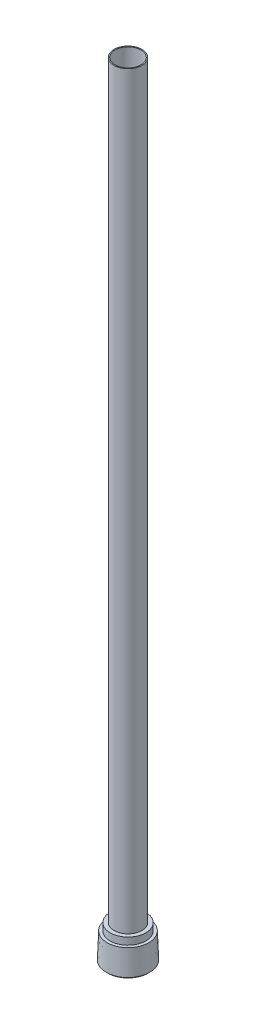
SolidWorks part; units mm, degrees
ref_plane "Front Plane" through (0, 0, 0) normal (0, 0, 1) x (1, 0, 0)
ref_plane "Top Plane" through (0, 0, 0) normal (0, 1, 0) x (1, 0, 0)
ref_plane "Right Plane" through (0, 0, 0) normal (1, 0, 0) x (0, 0, -1)
sketch "Sketch1" plane through (0, 0, 0) normal (1, 0, 0) x (0, 0, -1)
  line L0 (0, 304.8) -> (0, 0)
  line L1 (6.9342, 10.3124) -> (6.9342, 13.081)
  line L2 (6.9342, 13.081) -> (5.4229, 13.081)
  line L5 (8.4709, 0) -> (8.0949, 10.3124)
  line L6 (0, 0) -> (8.4709, 0)
  line L7 (8.0949, 10.3124) -> (6.9342, 10.3124)
  line L8 (5.4229, 13.081) -> (5.4229, 304.8)
  line L9 (5.4229, 304.8) -> (0, 304.8)
  line L10 (0, 0) -> (0, -49989.3417) construction
  dimension "D1" = 2.088
  dimension "PH" = 10.3124
  dimension "L" = 304.8
  dimension "OD" = 10.8458
  dimension "NPT" = 16.9418
  dimension "SH-D" = 13.8684
  dimension "SH" = 13.081
revolve "Revolve1" add sketch "Sketch1" angle 360 about L10
sketch "Sketch3" plane through (0, 0, 0) normal (0, -1, 0) x (-1, 0, 0)
  line L0 (0, 9.2983) -> (0, -9.2983) construction
  line L1 (0, -4.5754) -> (3.9624, -2.2877)
  line L2 (3.9624, -2.2877) -> (3.9624, 2.2877)
  line L3 (3.9624, 2.2877) -> (0, 4.5754)
  line L4 (0, 4.5754) -> (-3.9624, 2.2877)
  line L5 (-3.9624, 2.2877) -> (-3.9624, -2.2877)
  line L6 (-3.9624, -2.2877) -> (0, -4.5754)
  circle A0 centre (0, 0) radius 3.9624 construction
  dimension "HEX" = 7.9248
extrude "Cut-Extrude2" cut sketch "Sketch3" against normal blind 7.9248
sketch "Sketch2" plane through (0, 304.8, 0) normal (0, 1, 0) x (1, 0, 0)
  circle A0 centre (0, 0) radius 5.0419
  dimension "ID" = 10.0838
extrude "Cut-Extrude1" cut sketch "Sketch2" against normal up to surface (296.8752 mm away)
chamfer "Chamfer1" distance 0.508 angle 45 1 edges at (0, 0, 8.4709)
